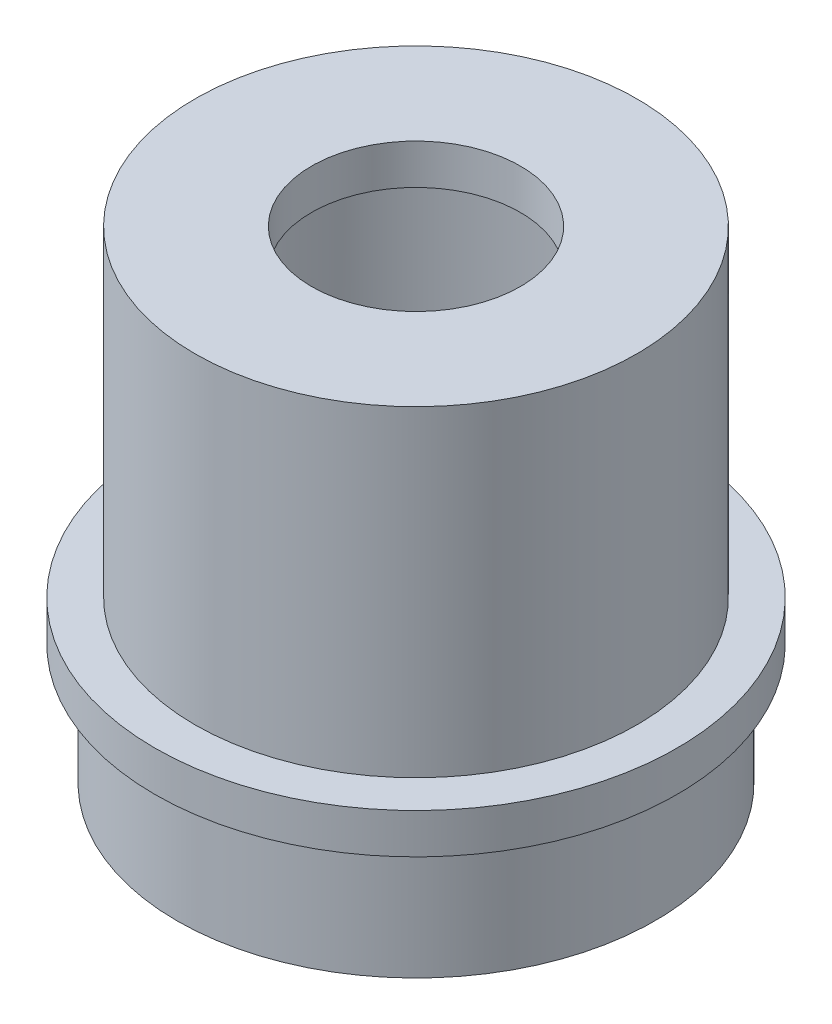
SolidWorks part; units mm, degrees
ref_plane "Alzado" through (0, 0, 0) normal (0, 0, 1) x (1, 0, 0)
ref_plane "Planta" through (0, 0, 0) normal (0, 1, 0) x (1, 0, 0)
ref_plane "Vista lateral" through (0, 0, 0) normal (1, 0, 0) x (0, 0, -1)
sketch "Croquis1" plane through (0, 0, 0) normal (0, 1, 0) x (1, 0, 0)
  circle A0 centre (0, 0) radius 5.5
extrude "Saliente-Extruir1" add sketch "Croquis1" along normal blind 1
sketch "Croquis2" plane through (0, 1, 0) normal (0, 1, 0) x (1, 0, 0)
  circle A0 centre (0, 0) radius 5.5
  circle A1 centre (0, 0) radius 5
extrude "Saliente-Extruir4" add sketch "Croquis2" along normal blind 2 contours A1 M2 | A0
sketch "Croquis3" plane through (0, 3, 0) normal (0, 1, 0) x (1, 0, 0)
  circle A0 centre (0, 0) radius 5
extrude "Cortar-Extruir1" cut sketch "Croquis3" against normal blind 2
sketch "Croquis4" plane through (0, 3, 0) normal (0, 1, 0) x (1, 0, 0)
  circle A0 centre (0, 0) radius 5.5
  circle A2 centre (0, 0) radius 6
extrude "Saliente-Extruir7" add sketch "Croquis4" along normal blind 1 contours A2
sketch "Croquis7" plane through (0, 4, 0) normal (0, 1, 0) x (1, 0, 0)
  circle A0 centre (0, 0) radius 5
extrude "Cortar-Extruir3" cut sketch "Croquis7" against normal blind 1
sketch "Croquis8" plane through (0, 4, 0) normal (0, 1, 0) x (1, 0, 0)
  circle A0 centre (0, 0) radius 5
  circle A1 centre (0, 0) radius 5.5
extrude "Saliente-Extruir8" add sketch "Croquis8" along normal blind 8
sketch "Croquis9" plane through (0, 12, 0) normal (0, 1, 0) x (1, 0, 0)
  circle A0 centre (0, 0) radius 5
extrude "Saliente-Extruir9" add sketch "Croquis9" against normal blind 1
sketch "Croquis10" plane through (0, 12, 0) normal (0, 1, 0) x (1, 0, 0)
  circle A0 centre (0, 0) radius 2.6
extrude "Cortar-Extruir4" cut sketch "Croquis10" against normal blind 1
sketch "Croquis11" plane through (0, 0, 0) normal (0, -1, 0) x (1, 0, 0)
  circle A0 centre (0, 0) radius 5.85
  circle A1 centre (0, 0) radius 5.5
extrude "Saliente-Extruir10" add sketch "Croquis11" against normal blind 3 contours A0
sketch "Croquis12" plane through (0, 3, 0) normal (0, -1, 0) x (1, 0, 0)
  circle A0 centre (0, 0) radius 6.5
  circle A1 centre (0, 0) radius 6
extrude "Saliente-Extruir11" add sketch "Croquis12" against normal blind 1
sketch "Croquis13" plane through (0, 0, 0) normal (0, -1, 0) x (1, 0, 0)
  circle A0 centre (0, 0) radius 5.975
extrude "Saliente-Extruir12" add sketch "Croquis13" against normal blind 3
sketch "Croquis14" plane through (0, 0, 0) normal (0, -1, 0) x (1, 0, 0)
  circle A0 centre (0, 0) radius 5.95
  circle A1 centre (0, 0) radius 5.975
extrude "Cortar-Extruir5" cut sketch "Croquis14" against normal blind 3
